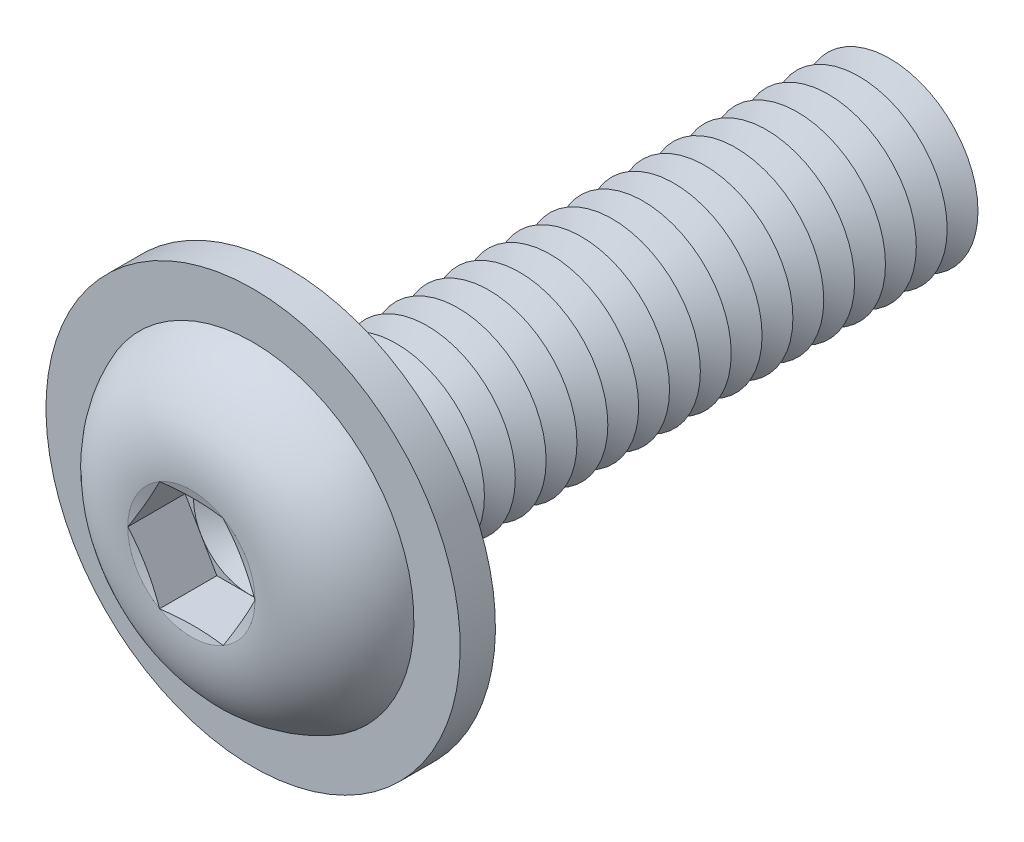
SolidWorks part; units mm, degrees
ref_plane "Front Plane" through (0, 0, 0) normal (0, 0, 1) x (1, 0, 0)
ref_plane "Top Plane" through (0, 0, 0) normal (0, 1, 0) x (1, 0, 0)
ref_plane "Right Plane" through (0, 0, 0) normal (1, 0, 0) x (0, 0, -1)
sketch "Sketch1" plane through (0, 0, 0) normal (1, 0, 0) x (0, 0, -1)
  line L0 (0, 2) -> (0, 3.8)
  line L3 (0, 2) -> (14, 2)
  line L4 (14, 2) -> (14, 0)
  line L5 (14, 0) -> (-2.2, 0) construction
  line L6 (-2.2, 0) -> (14, 0)
  line L7 (-2.2, 1.4434) -> (-2.2, 0.7217) construction
  line L8 (-2.2, 0.7217) -> (-2.2, 0)
  line L9 (-2.2, 1.4434) -> (-2.0066, 0.7217)
  line L10 (-2.0066, 0.7217) -> (-2.2, 0.7217)
  line L11 (14, 0) -> (22.7481, 0) construction
  line L12 (0, 3.8) -> (-2.2, 3.8) construction
  arc A1 (0, 3.8) -> (-2.2, 1.4434) centre (0, 1.5948) ccw
  point P8 (14, 1)
  dimension "D1" = 7.6
  dimension "D2" = 4
  dimension "D3" = 2.2
  dimension "D4" = 2.8868
  dimension "D5" = 14
  dimension "D6" = 15
revolve "Revolve1" add sketch "Sketch1" angle 360 about L5
fillet "Fillet1" radius 0.35 1 edges at (-2, 0, 0)
sketch "Sketch2" plane through (0, 0, 0) normal (1, 0, 0) x (0, 0, -1)
  line L0 (13.65, 2) -> (14.35, 2)
  line L1 (14, 2) -> (0.35, 2) construction
  line L2 (14.35, 2) -> (14, 1.3938)
  line L3 (14, -2) -> (14, 2) construction
  line L4 (14, 1.3938) -> (13.65, 2)
  dimension "D1" = 0.7
revolve "Cut-Revolve1" cut sketch "Sketch2" angle 360 about axis through (0, 0, -14) along (0, 0, -1)
pattern_linear "LPattern1" count 20 spacing 0.7 along (0, 0, 1) of "Cut-Revolve1"
sketch "Sketch3" plane through (0, 0, 2.2) normal (0, 0, 1) x (1, 0, 0)
  line L7 (0.7217, 1.25) -> (-0.7217, 1.25)
  line L8 (-0.7217, 1.25) -> (-1.4434, 0)
  line L9 (-1.4434, 0) -> (-0.7217, -1.25)
  line L10 (-0.7217, -1.25) -> (0.7217, -1.25)
  line L11 (0.7217, -1.25) -> (1.4434, 0)
  line L12 (1.4434, 0) -> (0.7217, 1.25)
  circle A0 centre (0, 0) radius 1.25 construction
  circle A3 centre (0, 0) radius 1.4434 construction
extrude "Cut-Extrude1" cut sketch "Sketch3" against normal blind 1.3
sketch "Sketch4" plane through (0, 0, 0.9) normal (0, 0, 1) x (1, 0, 0)
  line L1 (0.7217, 1.25) -> (-0.7217, 1.25) construction
  circle A0 centre (0, 0) radius 1.25
extrude "Cut-Extrude2" cut sketch "Sketch4" against normal through all draft 60
sketch "Sketch5" plane through (0, 0, 0) normal (0, 0, -1) x (-1, 0, 0)
  circle A0 centre (0, 0) radius 4.7
  circle A1 centre (0, 0) radius 2.35
  circle A2 centre (0, 0) radius 2.35 construction
  dimension "D1" = 9.4
extrude "Boss-Extrude1" add sketch "Sketch5" against normal blind 0.8
